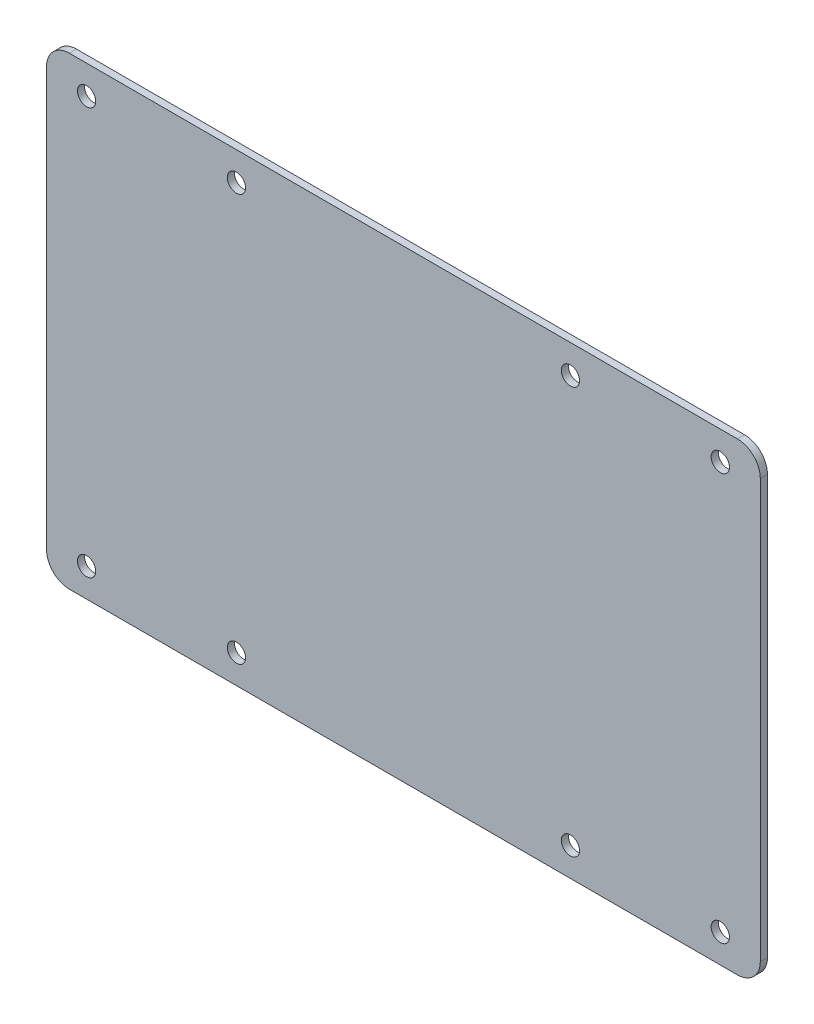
SolidWorks part; units mm, degrees
ref_plane "Front Plane" through (0, 0, 0) normal (0, 0, 1) x (1, 0, 0)
ref_plane "Top Plane" through (0, 0, 0) normal (0, 1, 0) x (1, 0, 0)
ref_plane "Right Plane" through (0, 0, 0) normal (1, 0, 0) x (0, 0, -1)
sketch "Sketch1" plane through (0, 0, 0) normal (0, 0, 1) x (1, 0, 0)
  line L0 (3.81, 84.05) -> (152.19, 84.05)
  line L1 (-1.27, 78.97) -> (-1.27, -13.97)
  line L2 (3.81, -19.05) -> (152.19, -19.05)
  line L3 (157.27, -13.97) -> (157.27, 78.97)
  arc A0 (-1.27, 78.97) -> (3.81, 84.05) centre (3.81, 78.97) cw
  arc A1 (3.81, 84.05) -> (-1.27, 78.97) centre (3.81, 78.97) ccw construction
  arc A2 (152.19, 84.05) -> (157.27, 78.97) centre (152.19, 78.97) cw
  arc A3 (-1.27, -13.97) -> (3.81, -19.05) centre (3.81, -13.97) ccw
  circle A4 centre (40.905, -12.7) radius 2.032
  circle A5 centre (7.62, -12.7) radius 2.032
  circle A6 centre (115.095, -12.7) radius 2.032
  circle A7 centre (148.38, -12.7) radius 2.032
  circle A8 centre (148.38, 77.7) radius 2.032
  circle A9 centre (115.095, 77.7) radius 2.032
  circle A10 centre (40.905, 77.7) radius 2.032
  circle A11 centre (7.62, 77.7) radius 2.032
  circle A12 centre (7.62, 77.7) radius 2.032 construction
  arc A13 (157.27, -13.97) -> (152.19, -19.05) centre (152.19, -13.97) cw
  arc A14 (152.19, -19.05) -> (157.27, -13.97) centre (152.19, -13.97) ccw construction
extrude "Boss-Extrude1" add sketch "Sketch1" along normal blind 1.5875
sketch "Sketch2" plane through (0, 0, 1.5875) normal (0, 0, 1) x (1, 0, 0)
  line L1 (17.78, 71.35) -> (30.48, 71.35)
  line L2 (17.78, 71.35) -> (17.78, 68.175)
  line L3 (17.78, 68.175) -> (30.48, 68.175)
  line L4 (30.48, 71.35) -> (30.48, 68.175)
  line L5 (49.53, 71.35) -> (62.23, 71.35)
  line L6 (49.53, 71.35) -> (49.53, 68.175)
  line L7 (49.53, 68.175) -> (62.23, 68.175)
  line L8 (62.23, 71.35) -> (62.23, 68.175)
  line L9 (93.77, 71.35) -> (106.47, 71.35)
  line L10 (93.77, 71.35) -> (93.77, 68.175)
  line L11 (93.77, 68.175) -> (106.47, 68.175)
  line L12 (106.47, 71.35) -> (106.47, 68.175)
  line L13 (125.52, 71.35) -> (138.22, 71.35)
  line L14 (125.52, 71.35) -> (125.52, 68.175)
  line L15 (125.52, 68.175) -> (138.22, 68.175)
  line L16 (138.22, 71.35) -> (138.22, 68.175)
  line L17 (125.52, -3.175) -> (138.22, -3.175)
  line L18 (125.52, -3.175) -> (125.52, -6.35)
  line L19 (125.52, -6.35) -> (138.22, -6.35)
  line L20 (138.22, -3.175) -> (138.22, -6.35)
  line L21 (93.77, -3.175) -> (106.47, -3.175)
  line L22 (93.77, -3.175) -> (93.77, -6.35)
  line L23 (93.77, -6.35) -> (106.47, -6.35)
  line L24 (106.47, -3.175) -> (106.47, -6.35)
  line L25 (17.78, -3.175) -> (30.48, -3.175)
  line L26 (17.78, -3.175) -> (17.78, -6.35)
  line L27 (17.78, -6.35) -> (30.48, -6.35)
  line L28 (30.48, -3.175) -> (30.48, -6.35)
  line L29 (49.53, -3.175) -> (62.23, -3.175)
  line L30 (49.53, -3.175) -> (49.53, -6.35)
  line L31 (49.53, -6.35) -> (62.23, -6.35)
  line L32 (62.23, -3.175) -> (62.23, -6.35)
extrude "Cut-Extrude1" cut sketch "Sketch2" against normal blind 3.175
